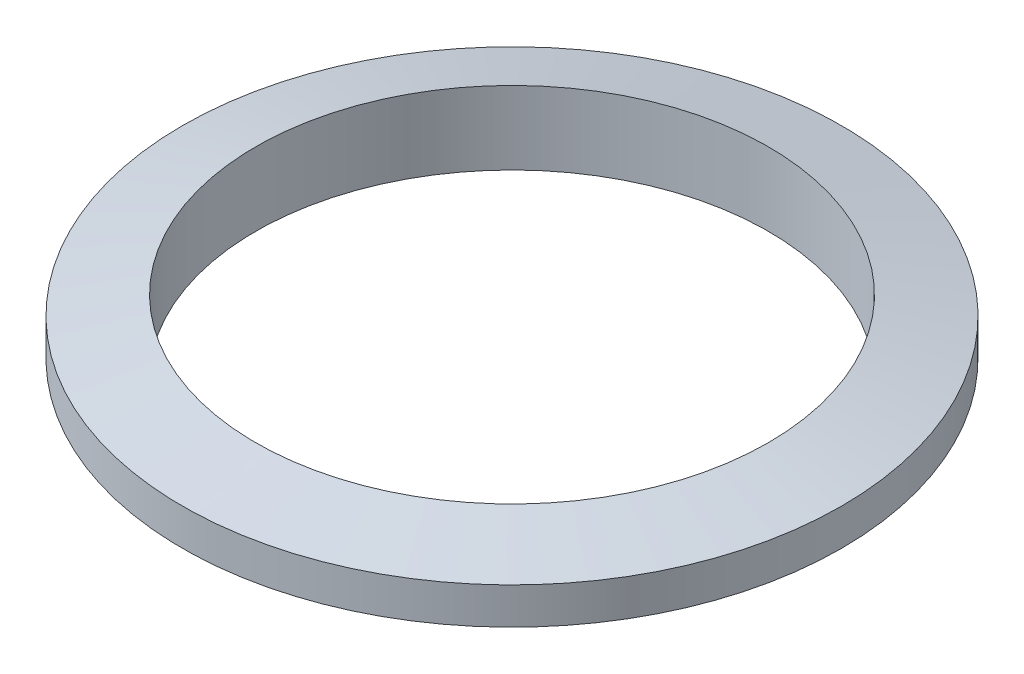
SolidWorks part; units mm, degrees
ref_plane "前视基准面" through (0, 0, 0) normal (0, 0, 1) x (1, 0, 0)
ref_plane "上视基准面" through (0, 0, 0) normal (0, 1, 0) x (1, 0, 0)
ref_plane "右视基准面" through (0, 0, 0) normal (1, 0, 0) x (0, 0, -1)
sketch "草图1" plane through (0, 0, 0) normal (0, 0, 1) x (1, 0, 0)
  line L0 (-9, 8.5) -> (-9, 9.5) construction
  line L1 (-7, 10) -> (-9, 9.5) construction
  line L2 (-7, 8) -> (-7, 10) construction
  line L3 (-7, 8) -> (-9, 8.5) construction
  line L4 (-9, 8.5) -> (-9, 9.5)
  line L5 (-7, 10) -> (-9, 9.5)
  line L6 (-7, 8) -> (-7, 10)
  line L7 (-7, 8) -> (-9, 8.5)
  line L8 (0, -4.1083) -> (0, 22.3238) construction
revolve "旋转1" add sketch "草图1" angle 360 about L8
